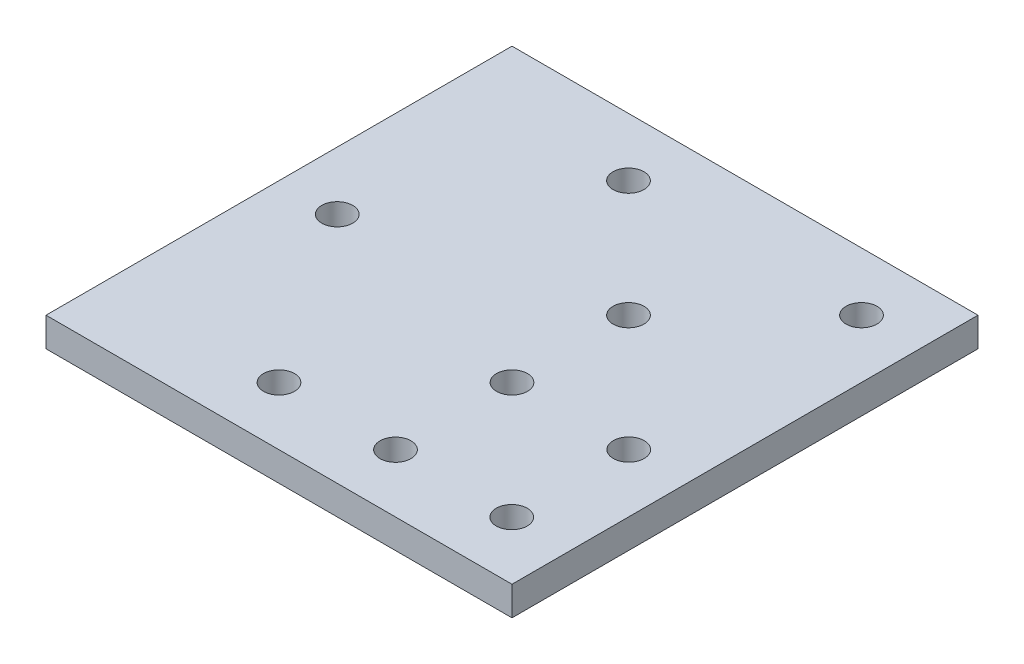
SolidWorks part; units mm, degrees
ref_plane "Front" through (0, 0, 0) normal (0, 0, 1) x (1, 0, 0)
ref_plane "Top" through (0, 0, 0) normal (0, 1, 0) x (1, 0, 0)
ref_plane "Right" through (0, 0, 0) normal (1, 0, 0) x (0, 0, -1)
sketch "Sketch1" plane through (0, 0, 0) normal (0, 1, 0) x (1, 0, 0)
  line L1 (0, 0) -> (101.6, 0)
  line L2 (0, 0) -> (0, 50.8)
  line L4 (101.6, 0) -> (101.6, 50.8)
  line L5 (38.1, 50.8) -> (118.3211, 50.8) construction
  line L6 (38.1, 126.5374) -> (12.7, 126.5374) construction
  line L7 (25.4, 126.5374) -> (25.4, 145.0443) construction
  line L9 (0, 50.8) -> (0, 101.6)
  line L10 (0, 101.6) -> (101.6, 101.6)
  line L11 (101.6, 50.8) -> (101.6, 101.6)
  circle A2 centre (88.9, 38.1534) radius 3.3731
  circle A3 centre (63.5, 12.7) radius 3.3731
  circle A5 centre (88.9, 88.9) radius 3.3731
  circle A6 centre (63.5, 63.5) radius 3.3731
  circle A7 centre (88.9, 12.6466) radius 3.3731
  circle A8 centre (63.5, 38.1) radius 3.3731
  circle A9 centre (38.1, 12.7) radius 3.3731
  circle A10 centre (38.1, 88.9) radius 3.3731
  circle A11 centre (12.7, 50.8) radius 3.3731
  dimension "D8" = 12.7
  dimension "D9" = 25.4
  dimension "D12" = 12.7
  dimension "D14" = 63.5
  dimension "D13" = 12.7
  dimension "D15" = 25.4
  dimension "D1" = 50.8
  dimension "D2" = 101.6
  dimension "D10" = 50.8
extrude "Extrude1" add sketch "Sketch1" along normal blind 6.35
